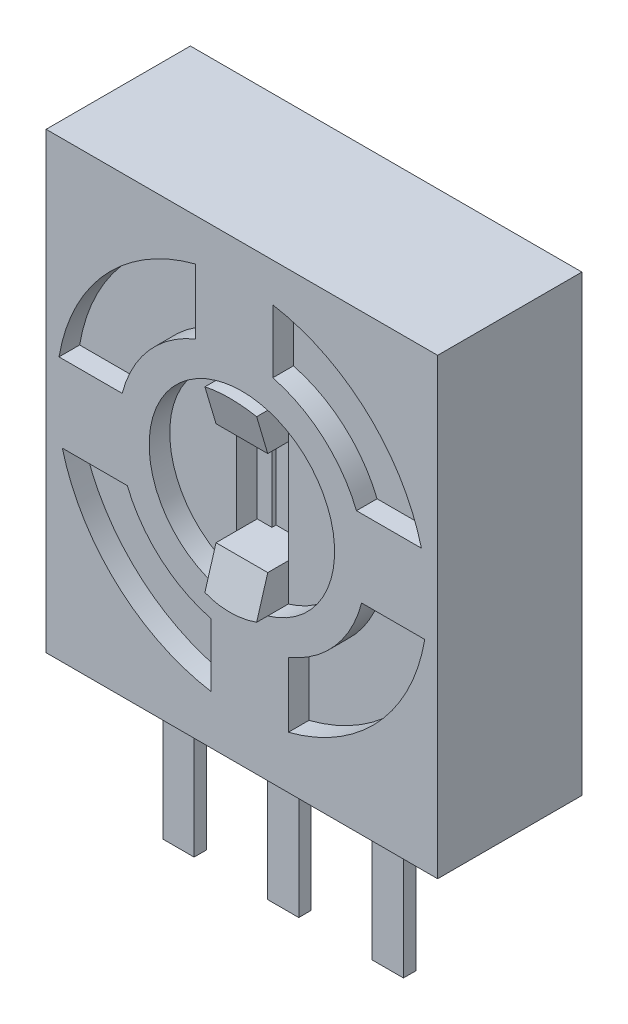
SolidWorks part; units mm, degrees
ref_plane "Plan de face" through (0, 0, 0) normal (0, 0, 1) x (1, 0, 0)
ref_plane "Plan de dessus" through (0, 0, 0) normal (0, 1, 0) x (1, 0, 0)
ref_plane "Plan de droite" through (0, 0, 0) normal (1, 0, 0) x (0, 0, -1)
sketch "Esquisse1" plane through (0, 0, 0) normal (0, 0, 1) x (1, 0, 0)
  line L1 (0, 0) -> (9.5, 0)
  line L2 (0, 0) -> (0, 11)
  line L3 (0, 11) -> (9.5, 11)
  line L4 (9.5, 0) -> (9.5, 11)
  dimension "D1" = 9.5
  dimension "D2" = 11
extrude "Extrusion1" add sketch "Esquisse1" along normal blind 3.5
sketch "Esquisse2" plane through (0, 0, 3.5) normal (0, 0, 1) x (1, 0, 0)
  line L0 (5.5, 11.4053) -> (5.5, 6.5288) construction
  line L1 (9.5, 0) -> (9.5, 11) construction
  line L2 (4.215, 6.75) -> (11.4578, 6.75) construction
  line L3 (9.5, 11) -> (0, 11) construction
  line L4 (0, 5.6235) -> (9.5, 5.6235) construction
  line L5 (0, 11) -> (0, 0) construction
  line L6 (5.5, 10.0605) -> (5.5, 8.5282)
  line L7 (7.5304, 6.75) -> (9.1067, 6.75)
  line L8 (9.1871, 4.8735) -> (7.6547, 4.8735)
  line L9 (5.8765, 2.843) -> (5.8765, 1.2667)
  line L10 (4, 1.1864) -> (4, 2.7187)
  line L11 (1.9696, 4.4969) -> (0.3933, 4.4969)
  line L12 (0.3129, 6.3735) -> (1.8453, 6.3735)
  line L13 (3.6235, 8.4039) -> (3.6235, 9.9802)
  arc A0 (7.6547, 4.8735) -> (5.8765, 2.843) centre (4.75, 5.6235) cw
  arc A1 (9.1871, 4.8735) -> (5.8765, 1.2667) centre (4.75, 5.6235) cw
  arc A2 (5.5, 8.5282) -> (7.5304, 6.75) centre (4.75, 5.6235) cw
  arc A3 (5.5, 10.0605) -> (9.1067, 6.75) centre (4.75, 5.6235) cw
  arc A4 (4, 2.7187) -> (1.9696, 4.4969) centre (4.75, 5.6235) cw
  arc A5 (4, 1.1864) -> (0.3933, 4.4969) centre (4.75, 5.6235) cw
  arc A6 (1.8453, 6.3735) -> (3.6235, 8.4039) centre (4.75, 5.6235) cw
  arc A7 (0.3129, 6.3735) -> (3.6235, 9.9802) centre (4.75, 5.6235) cw
  circle A8 centre (4.75, 5.6235) radius 2.25
  dimension "D1" = 4
  dimension "D2" = 4.25
extrude "Enlèv. mat.-Extru.1" cut sketch "Esquisse2" against normal blind 0.5
sketch "Esquisse3" plane through (0, 0, 0) normal (0, -1, 0) x (1, 0, 0)
  line L0 (9.5, 2.5) -> (0, 2.5) construction
  line L1 (9.5, 3.5) -> (9.5, 0) construction
  line L2 (0, 3.5) -> (0, 0) construction
  line L3 (0, 3.5) -> (9.5, 3.5) construction
  line L4 (4.75, 2.2) -> (4.75, 2.4064) construction
  line L5 (5.13, 2.5) -> (4.37, 2.5)
  line L6 (5.13, 2.5) -> (5.13, 2.2)
  line L7 (5.13, 2.2) -> (4.37, 2.2)
  line L8 (4.37, 2.5) -> (4.37, 2.2)
  line L9 (4.75, 2.5) -> (4.75, 2.0808) construction
  line L10 (7.67, 2.5) -> (6.91, 2.5)
  line L11 (7.67, 2.5) -> (7.67, 2.2)
  line L12 (7.67, 2.2) -> (6.91, 2.2)
  line L13 (6.91, 2.5) -> (6.91, 2.2)
  line L14 (7.29, 2.2) -> (7.29, 2.4064) construction
  line L15 (7.29, 2.5) -> (7.29, 2.0808) construction
  line L16 (2.59, 2.5) -> (1.83, 2.5)
  line L17 (2.59, 2.5) -> (2.59, 2.2)
  line L18 (2.59, 2.2) -> (1.83, 2.2)
  line L19 (1.83, 2.5) -> (1.83, 2.2)
  line L20 (2.21, 2.2) -> (2.21, 2.4064) construction
  line L21 (2.21, 2.5) -> (2.21, 2.0808) construction
  dimension "D1" = 1
  dimension "D2" = 0.3
  dimension "D3" = 0.76
extrude "Extrusion2" add sketch "Esquisse3" along normal blind 3.5
sketch "Esquisse4" plane through (0, 0, 3) normal (0, 0, 1) x (1, 0, 0)
  line L0 (4.75, 3.4628) -> (4.75, 4.6788) construction
  line L1 (4.1223, 6.8735) -> (5.3777, 6.8735)
  line L2 (5.3777, 7.7841) -> (5.3777, 6.8735)
  line L3 (5.3777, 5.6235) -> (3.3642, 5.6235) construction
  line L4 (4.1223, 7.7841) -> (4.1223, 6.8735)
  line L5 (4.75, 5.6235) -> (4.75, 7.271) construction
  line L6 (4.1223, 4.3735) -> (5.3777, 4.3735)
  line L7 (4.1223, 4.3735) -> (4.1223, 3.4628)
  line L8 (5.3777, 4.3735) -> (5.3777, 3.4628)
  circle A0 centre (4.75, 5.6235) radius 2.25 construction
  arc A1 (4.1223, 7.7841) -> (5.3777, 7.7841) centre (4.75, 5.6235) cw
  arc A2 (4.1223, 3.4628) -> (5.3777, 3.4628) centre (4.75, 5.6235) ccw
  dimension "D1" = 1.25
extrude "Extrusion3" add sketch "Esquisse4" along normal blind 0.8
sketch "Esquisse5" plane through (0, 0, 3) normal (0, 0, 1) x (1, 0, 0)
  line L1 (4.1223, 6.8735) -> (5.3777, 6.8735)
  line L2 (4.1223, 6.8735) -> (4.1223, 4.3735)
  line L3 (4.1223, 4.3735) -> (5.3777, 4.3735)
  line L4 (5.3777, 6.8735) -> (5.3777, 4.3735)
extrude "Enlèv. mat.-Extru.2" cut sketch "Esquisse5" against normal blind 0.5
sketch "Esquisse6" plane through (0, 0, 2.5) normal (0, 0, 1) x (1, 0, 0)
  line L0 (4.75, 6.8735) -> (4.1223, 6.1251)
  line L1 (4.1223, 6.8735) -> (5.3777, 6.8735) construction
  line L2 (4.1223, 6.8735) -> (4.1223, 4.3735) construction
  line L3 (4.1223, 6.1251) -> (4.4795, 6.1251)
  line L4 (4.4795, 6.1251) -> (4.4795, 4.3735)
  line L5 (5.3777, 4.3735) -> (4.1223, 4.3735) construction
  line L6 (4.75, 6.8735) -> (4.75, 4.3735) construction
  line L7 (5.0205, 6.1251) -> (5.0205, 4.3735)
  line L8 (5.3777, 6.1251) -> (5.0205, 6.1251)
  line L9 (4.75, 6.8735) -> (5.3777, 6.1251)
  line L10 (4.4795, 4.3735) -> (5.0205, 4.3735)
extrude "Enlèv. mat.-Extru.3" cut sketch "Esquisse6" against normal blind 0.1
sketch "Esquisse7" plane through (4.1223, 0, 0) normal (-1, 0, 0) x (0, 0, 1)
  line L0 (3.5, 4.3735) -> (3.832, 3.2522)
  line L1 (3.5, 11) -> (3.5, 0) construction
  line L2 (3.8, 4.3735) -> (3, 4.3735) construction
  line L5 (4.3465, 3.2522) -> (3.832, 3.2522)
  line L6 (4.3465, 3.2522) -> (4.3465, 5.0766)
  line L7 (4.3465, 5.0766) -> (3.5, 4.3735)
  line L8 (3.5, 4.3735) -> (3.5, 6.8735) construction
  line L9 (3.8, 6.8735) -> (3, 6.8735) construction
  line L10 (3.5, 5.6235) -> (4.6784, 5.6235) construction
  line L11 (4.3465, 6.1703) -> (3.5, 6.8735)
  line L12 (4.3465, 7.9948) -> (4.3465, 6.1703)
  line L13 (4.3465, 7.9948) -> (3.832, 7.9948)
  line L14 (3.5, 6.8735) -> (3.832, 7.9948)
extrude "Enlèv. mat.-Extru.4" cut sketch "Esquisse7" against normal through all
